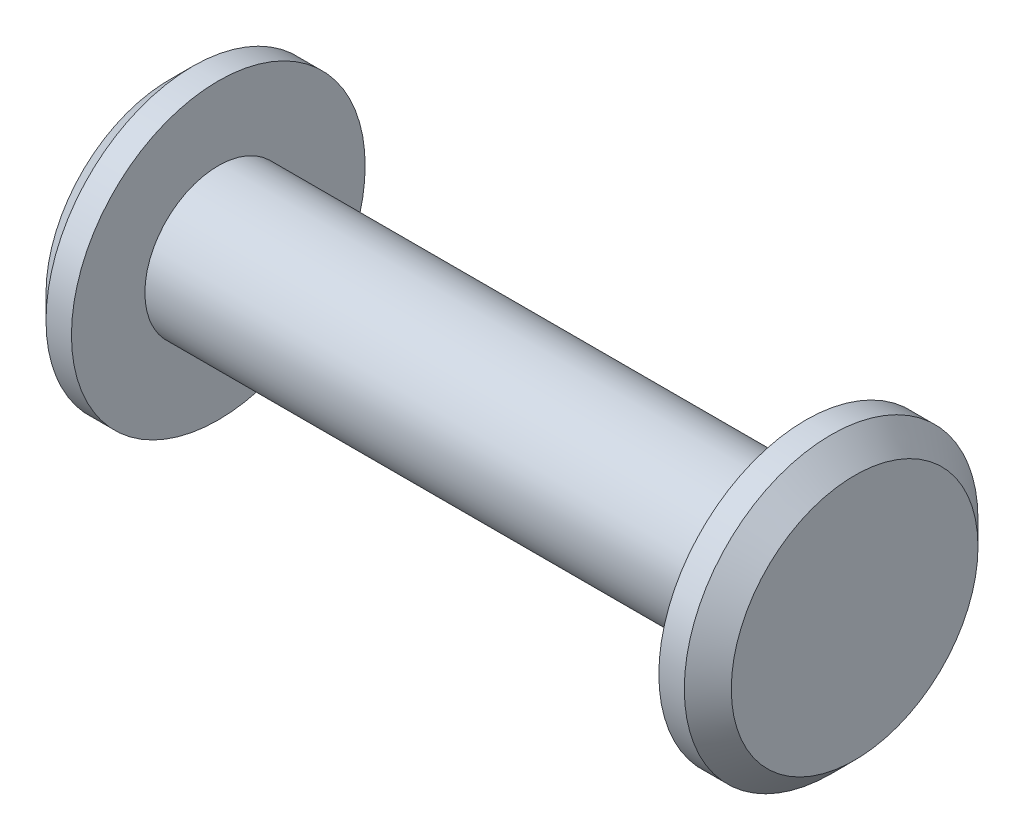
SolidWorks part; units mm, degrees
ref_plane "front" through (0, 0, 0) normal (0, 0, 1) x (1, 0, 0)
ref_plane "top" through (0, 0, 0) normal (0, 1, 0) x (1, 0, 0)
ref_plane "side" through (0, 0, 0) normal (1, 0, 0) x (0, 0, -1)
sketch "Sketch1" plane through (0, 0, 0) normal (0, 0, 1) x (1, 0, 0)
  line L0 (0, 0) -> (55.8636, 0) construction
  line L1 (11.1125, 0) -> (11.1125, 4.7625)
  line L2 (11.1125, 4.7625) -> (9.525, 4.7625)
  line L3 (9.525, 4.7625) -> (9.525, 2.3813)
  line L4 (9.525, 2.3813) -> (-9.525, 2.3813)
  line L5 (0, 0) -> (0, 55.2608) construction
  line L6 (-11.1125, 0) -> (11.1125, 0)
  line L7 (-9.525, 4.7625) -> (-9.525, 2.3813)
  line L8 (-11.1125, 4.7625) -> (-9.525, 4.7625)
  line L9 (-11.1125, 0) -> (-11.1125, 4.7625)
  point P12 (11.1125, -4.7625)
  point P13 (9.525, 2.3813)
  point P14 (9.525, -2.3813)
  dimension "D1" = 19.05
  dimension "D2" = 22.225
  dimension "D3" = 4.7625
  dimension "D4" = 9.525
revolve "Base-Revolve" add sketch "Sketch1" angle 360 about L0
chamfer "Chamfer1" distance 0.762 angle 45 2 edges at (11.1125, 0, 4.7625) (-11.1125, 0, 4.7625)
